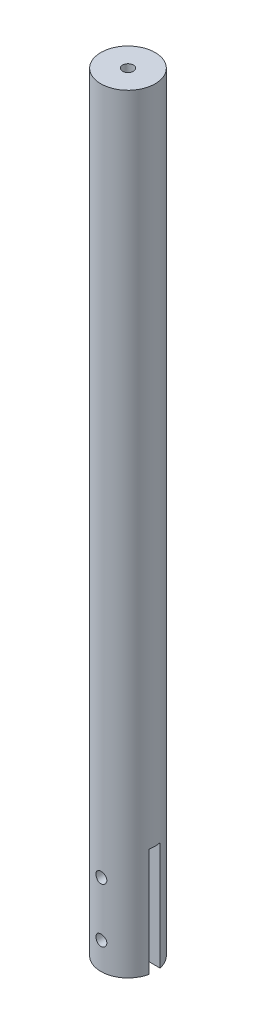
SolidWorks part; units mm, degrees
ref_plane "Alzado" through (0, 0, 0) normal (0, 0, 1) x (1, 0, 0)
ref_plane "Planta" through (0, 0, 0) normal (0, 1, 0) x (1, 0, 0)
ref_plane "Vista lateral" through (0, 0, 0) normal (1, 0, 0) x (0, 0, -1)
sketch "Croquis2" plane through (0, 0, 0) normal (0, 1, 0) x (1, 0, 0)
  circle A0 centre (0, 0) radius 15
  dimension "D1" = 30
extrude "Saliente-Extruir1" add sketch "Croquis2" along normal blind 425
sketch "Croquis3" plane through (0, 425, 0) normal (0, 1, 0) x (1, 0, 0)
  circle A0 centre (0, 0) radius 3
  dimension "D1" = 6
extrude "Cortar-Extruir1" cut sketch "Croquis3" against normal blind 30
sketch "Croquis4" plane through (0, 0, 0) normal (0, -1, 0) x (1, 0, 0)
  line L1 (-26.105, -3) -> (26.105, -3)
  line L2 (-26.105, -3) -> (-26.105, 3)
  line L3 (-26.105, 3) -> (26.105, 3)
  line L4 (26.105, -3) -> (26.105, 3)
  line L5 (-26.105, -3) -> (26.105, 3) construction
  line L6 (-26.105, 3) -> (26.105, -3) construction
  point P0 (0, 0)
  dimension "D1" = 6
extrude "Cortar-Extruir2" cut sketch "Croquis4" against normal blind 60
sketch "Croquis5" plane through (0, 0, 0) normal (0, 0, 1) x (1, 0, 0)
  line L0 (0, 0) -> (0, 15) construction
  line L1 (0, 15) -> (0, 45) construction
  circle A0 centre (0, 45) radius 3
  circle A1 centre (0, 15) radius 3
  dimension "D1" = 6
  dimension "D2" = 15
  dimension "D3" = 30
extrude "Cortar-Extruir3" cut sketch "Croquis5" against normal through all and the other way through all
